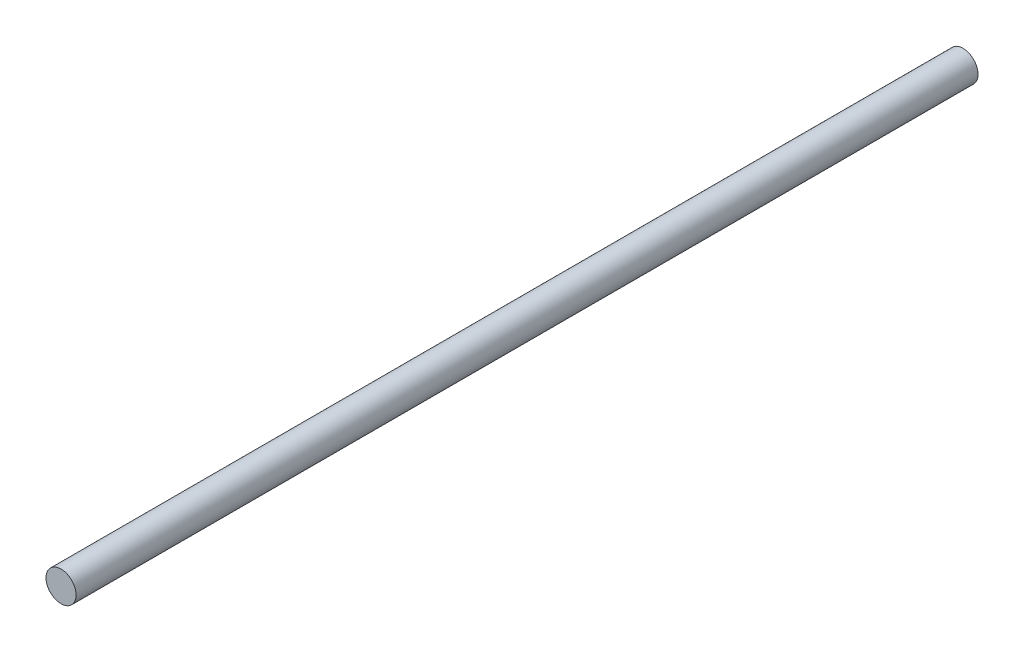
SolidWorks part; units mm, degrees
ref_plane "Front Plane" through (0, 0, 0) normal (0, 0, 1) x (1, 0, 0)
ref_plane "Top Plane" through (0, 0, 0) normal (0, 1, 0) x (1, 0, 0)
ref_plane "Right Plane" through (0, 0, 0) normal (1, 0, 0) x (0, 0, -1)
sketch "Sketch1" plane through (0, 0, 0) normal (0, 0, 1) x (1, 0, 0)
  circle A0 centre (0, 0) radius 3
  dimension "D1" = 6
extrude "Extrude1" add sketch "Sketch1" along normal blind 180
